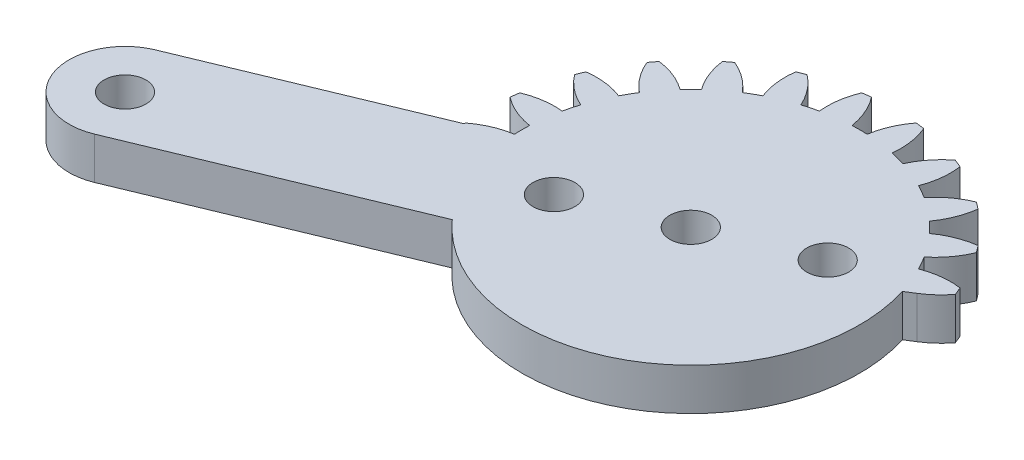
SolidWorks part; units mm, degrees
ref_plane "Front Plane" through (0, 0, 0) normal (0, 0, 1) x (1, 0, 0)
ref_plane "Top Plane" through (0, 0, 0) normal (0, 1, 0) x (1, 0, 0)
ref_plane "Right Plane" through (0, 0, 0) normal (1, 0, 0) x (0, 0, -1)
sketch "Sketch1" plane through (0, 0, 0) normal (0, 1, 0) x (1, 0, 0)
  line L0 (20.6437, 4) -> (2.0816, 4)
  line L1 (2.0816, -4) -> (20.6437, -4)
  arc A0 (2.0816, 4) -> (3.5217, 5.3071) centre (-0.7683, 8.5867) ccw
  arc A1 (3.5217, 5.3071) -> (3.2829, 5.8838) centre (-10.1063, 0) ccw
  arc A2 (3.2829, 5.8838) -> (0.6271, 5.5703) centre (2.5684, 0.5313) ccw
  arc A3 (0.6271, 5.5703) -> (0.0844, 6.5103) centre (-10.1063, 0) ccw
  arc A4 (0.0844, 6.5103) -> (1.6838, 8.6535) centre (-3.3089, 10.711) ccw
  arc A5 (1.6838, 8.6535) -> (1.3038, 9.1487) centre (-10.1063, 0) ccw
  arc A6 (1.3038, 9.1487) -> (-1.1803, 8.1585) centre (1.999, 3.7936) ccw
  arc A7 (-1.1803, 8.1585) -> (-1.9479, 8.926) centre (-10.1063, 0) ccw
  arc A8 (-1.9479, 8.926) -> (-0.9576, 11.4102) centre (-6.3127, 12.1053) ccw
  arc A9 (-0.9576, 11.4102) -> (-1.4528, 11.7901) centre (-10.1063, 0) ccw
  arc A10 (-1.4528, 11.7901) -> (-3.596, 10.1907) centre (0.6046, 6.7975) ccw
  arc A11 (-3.596, 10.1907) -> (-4.5361, 10.7334) centre (-10.1063, 0) ccw
  arc A12 (-4.5361, 10.7334) -> (-4.2225, 13.3892) centre (-9.5751, 12.6747) ccw
  arc A13 (-4.2225, 13.3892) -> (-4.7992, 13.6281) centre (-10.1063, 0) ccw
  arc A14 (-4.7992, 13.6281) -> (-6.4554, 11.5285) centre (-1.5196, 9.3381) ccw
  arc A15 (-6.4554, 11.5285) -> (-7.5039, 11.8094) centre (-10.1063, 0) ccw
  arc A16 (-7.5039, 11.8094) -> (-7.8884, 14.4558) centre (-12.8736, 12.3803) ccw
  arc A17 (-7.8884, 14.4558) -> (-8.5072, 14.5373) centre (-10.1063, 0) ccw
  arc A18 (-8.5072, 14.5373) -> (-9.5636, 12.0806) centre (-4.2291, 11.2423) ccw
  arc A19 (-9.5636, 12.0806) -> (-10.6491, 12.0806) centre (-10.1063, 0) ccw
  arc A20 (-10.6491, 12.0806) -> (-11.7054, 14.5373) centre (-15.9836, 11.2423) ccw
  arc A21 (-11.7054, 14.5373) -> (-12.3243, 14.4558) centre (-10.1063, 0) ccw
  arc A22 (-12.3243, 14.4558) -> (-12.7088, 11.8094) centre (-7.3391, 12.3803) ccw
  arc A23 (-12.7088, 11.8094) -> (-13.7573, 11.5285) centre (-10.1063, 0) ccw
  arc A24 (-13.7573, 11.5285) -> (-15.4135, 13.6281) centre (-18.6931, 9.3381) ccw
  arc A25 (-15.4135, 13.6281) -> (-15.9901, 13.3892) centre (-10.1063, 0) ccw
  arc A26 (-15.9901, 13.3892) -> (-15.6766, 10.7334) centre (-10.6376, 12.6747) ccw
  arc A27 (-15.6766, 10.7334) -> (-16.6166, 10.1907) centre (-10.1063, 0) ccw
  arc A28 (-16.6166, 10.1907) -> (-18.7599, 11.7901) centre (-20.8173, 6.7975) ccw
  arc A29 (-18.7599, 11.7901) -> (-19.255, 11.4102) centre (-10.1063, 0) ccw
  arc A30 (-19.255, 11.4102) -> (-18.2648, 8.926) centre (-13.9, 12.1053) ccw
  arc A31 (-18.2648, 8.926) -> (-19.0324, 8.1585) centre (-10.1063, 0) ccw
  arc A32 (-19.0324, 8.1585) -> (-21.5165, 9.1487) centre (-22.2117, 3.7936) ccw
  arc A33 (-21.5165, 9.1487) -> (-21.8965, 8.6535) centre (-10.1063, 0) ccw
  arc A34 (-21.8965, 8.6535) -> (-20.2971, 6.5103) centre (-16.9038, 10.711) ccw
  arc A35 (-20.2971, 6.5103) -> (-20.8398, 5.5703) centre (-10.1063, 0) ccw
  arc A36 (-20.8398, 5.5703) -> (-23.4956, 5.8838) centre (-22.7811, 0.5313) ccw
  arc A37 (-23.4956, 5.8838) -> (-23.7344, 5.3071) centre (-10.1063, 0) ccw
  arc A38 (-23.7344, 5.3071) -> (-21.6348, 3.6509) centre (-19.4444, 8.5867) ccw
  arc A39 (-21.6348, 3.6509) -> (-21.9157, 2.6025) centre (-10.1063, 0) ccw
  arc A40 (-21.9157, 2.6025) -> (-24.5622, 2.2179) centre (-22.4867, -2.7673) ccw
  arc A41 (-24.5622, 2.2179) -> (-24.6437, 1.5991) centre (-10.1063, 0) ccw
  arc A42 (-24.6437, 1.5991) -> (-22.1869, 0.5427) centre (-21.3486, 5.8773) ccw
  arc A43 (-22.1869, 0.5427) -> (-22.1869, -0.5427) centre (-10.1063, 0) ccw
  arc A44 (-22.1869, -0.5427) -> (-24.6437, -1.5991) centre (-21.3486, -5.8773) ccw
  arc A45 (-24.6437, -1.5991) -> (-24.5622, -2.2179) centre (-10.1063, 0) ccw
  arc A46 (-24.5622, -2.2179) -> (-21.9157, -2.6025) centre (-22.4867, 2.7673) ccw
  arc A47 (-21.9157, -2.6025) -> (-21.6348, -3.6509) centre (-10.1063, 0) ccw
  arc A48 (-21.6348, -3.6509) -> (-23.7344, -5.3071) centre (-19.4444, -8.5867) ccw
  arc A49 (-23.7344, -5.3071) -> (-23.4956, -5.8838) centre (-10.1063, 0) ccw
  arc A50 (-23.4956, -5.8838) -> (-20.8398, -5.5703) centre (-22.7811, -0.5313) ccw
  arc A51 (-20.8398, -5.5703) -> (-20.2971, -6.5103) centre (-10.1063, 0) ccw
  arc A52 (-20.2971, -6.5103) -> (-21.8965, -8.6535) centre (-16.9038, -10.711) ccw
  arc A53 (-21.8965, -8.6535) -> (-21.5165, -9.1487) centre (-10.1063, 0) ccw
  arc A54 (-21.5165, -9.1487) -> (-19.0324, -8.1585) centre (-22.2117, -3.7936) ccw
  arc A55 (-19.0324, -8.1585) -> (-18.2648, -8.926) centre (-10.1063, 0) ccw
  arc A56 (-18.2648, -8.926) -> (-19.255, -11.4102) centre (-13.9, -12.1053) ccw
  arc A57 (-19.255, -11.4102) -> (-18.7599, -11.7901) centre (-10.1063, 0) ccw
  arc A58 (-18.7599, -11.7901) -> (-16.6166, -10.1907) centre (-20.8173, -6.7975) ccw
  arc A59 (-16.6166, -10.1907) -> (-15.6766, -10.7334) centre (-10.1063, 0) ccw
  arc A60 (-15.6766, -10.7334) -> (-15.9901, -13.3892) centre (-10.6376, -12.6747) ccw
  arc A61 (-15.9901, -13.3892) -> (-15.4135, -13.6281) centre (-10.1063, 0) ccw
  arc A62 (-15.4135, -13.6281) -> (-13.7573, -11.5285) centre (-18.6931, -9.3381) ccw
  arc A63 (-13.7573, -11.5285) -> (-12.7088, -11.8094) centre (-10.1063, 0) ccw
  arc A64 (-12.7088, -11.8094) -> (-12.3243, -14.4558) centre (-7.3391, -12.3803) ccw
  arc A65 (-12.3243, -14.4558) -> (-11.7054, -14.5373) centre (-10.1063, 0) ccw
  arc A66 (-11.7054, -14.5373) -> (-10.6491, -12.0806) centre (-15.9836, -11.2423) ccw
  arc A67 (-10.6491, -12.0806) -> (-9.5636, -12.0806) centre (-10.1063, 0) ccw
  arc A68 (-9.5636, -12.0806) -> (-8.5072, -14.5373) centre (-4.2291, -11.2423) ccw
  arc A69 (-8.5072, -14.5373) -> (-7.8884, -14.4558) centre (-10.1063, 0) ccw
  arc A70 (-7.8884, -14.4558) -> (-7.5039, -11.8094) centre (-12.8736, -12.3803) ccw
  arc A71 (-7.5039, -11.8094) -> (-6.4554, -11.5285) centre (-10.1063, 0) ccw
  arc A72 (-6.4554, -11.5285) -> (-4.7992, -13.6281) centre (-1.5196, -9.3381) ccw
  arc A73 (-4.7992, -13.6281) -> (-4.2225, -13.3892) centre (-10.1063, 0) ccw
  arc A74 (-4.2225, -13.3892) -> (-4.5361, -10.7334) centre (-9.5751, -12.6747) ccw
  arc A75 (-4.5361, -10.7334) -> (-3.596, -10.1907) centre (-10.1063, 0) ccw
  arc A76 (-3.596, -10.1907) -> (-1.4528, -11.7901) centre (0.6046, -6.7975) ccw
  arc A77 (-1.4528, -11.7901) -> (-0.9576, -11.4102) centre (-10.1063, 0) ccw
  arc A78 (-0.9576, -11.4102) -> (-1.9479, -8.926) centre (-6.3127, -12.1053) ccw
  arc A79 (-1.9479, -8.926) -> (-1.1803, -8.1585) centre (-10.1063, 0) ccw
  arc A80 (-1.1803, -8.1585) -> (1.3038, -9.1487) centre (1.999, -3.7936) ccw
  arc A81 (1.3038, -9.1487) -> (1.6838, -8.6535) centre (-10.1063, 0) ccw
  arc A82 (1.6838, -8.6535) -> (0.0844, -6.5103) centre (-3.3089, -10.711) ccw
  arc A83 (0.0844, -6.5103) -> (0.6271, -5.5703) centre (-10.1063, 0) ccw
  arc A84 (0.6271, -5.5703) -> (3.2829, -5.8838) centre (2.5684, -0.5313) ccw
  arc A85 (3.2829, -5.8838) -> (3.5217, -5.3071) centre (-10.1063, 0) ccw
  arc A86 (3.5217, -5.3071) -> (2.0816, -4) centre (-0.7683, -8.5867) ccw
  arc A87 (20.6437, -4) -> (20.6437, 4) centre (20.6437, 0) ccw
  circle A88 centre (-10.1063, 0) radius 1.5
  circle A89 centre (20.6437, 0) radius 1.5
  dimension "D1" = 3
  dimension "D2" = 3
extrude "Boss-Extrude1" add sketch "Sketch1" along normal blind 3
sketch "Sketch3" plane through (0, 3, 0) normal (0, 1, 0) x (1, 0, 0)
  line L0 (-10.1063, 0) -> (-40.8563, 0) construction
  line L1 (-10.1063, 0) -> (-38.7466, -11.8632)
  line L2 (-11.6371, 3.6955) -> (-40.2773, -8.1677)
  line L3 (-8.5756, -3.6955) -> (-37.2159, -15.5587)
  circle A0 centre (-10.1063, 0) radius 1.5
  circle A1 centre (20.6437, 0) radius 1.5 construction
  circle A2 centre (20.6437, 0) radius 1.5
  circle A3 centre (-38.7466, -11.8632) radius 1.5
  circle A4 centre (-38.7466, -11.8632) radius 4
  circle A5 centre (-10.1063, 0) radius 4
  dimension "D2" = 3
  dimension "D5" = 3
  dimension "D6" = 8
  dimension "D7" = 8
  dimension "D1" = 30.75
  dimension "D3" = 31
  dimension "D4" = 22.5
extrude "Boss-Extrude2" add sketch "Sketch3" against normal blind 3
sketch "Sketch4"
  dimension "D2" = 24.1855
  dimension "D3" = 3
  dimension "D4" = 15
  dimension "D1" = 0
extrude "Cut-Extrude1" cut sketch "Sketch4" against normal blind 3
